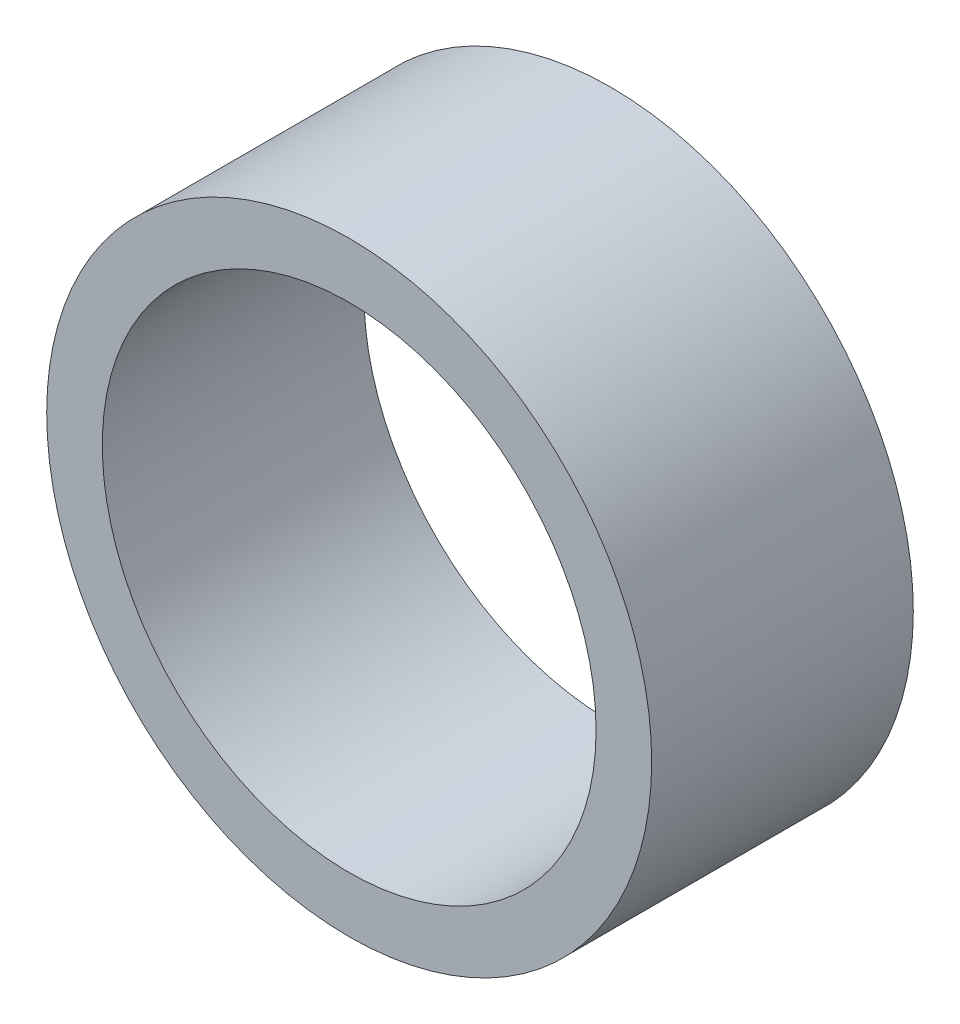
SolidWorks part; units mm, degrees
ref_plane "Plan1" through (0, 0, 0) normal (0, 0, 1) x (1, 0, 0)
ref_plane "Plan2" through (0, 0, 0) normal (0, 1, 0) x (1, 0, 0)
ref_plane "Plan3" through (0, 0, 0) normal (1, 0, 0) x (0, 0, -1)
sketch "Esquisse1" plane through (0, 0, 0) normal (0, 0, 1) x (1, 0, 0)
  circle A0 centre (0, 0) radius 18.5
  circle A1 centre (0, 0) radius 15.1
  dimension "D1" = 37
  dimension "D2" = 30.2
extrude "Base-Extrusion" add sketch "Esquisse1" along normal blind 16
